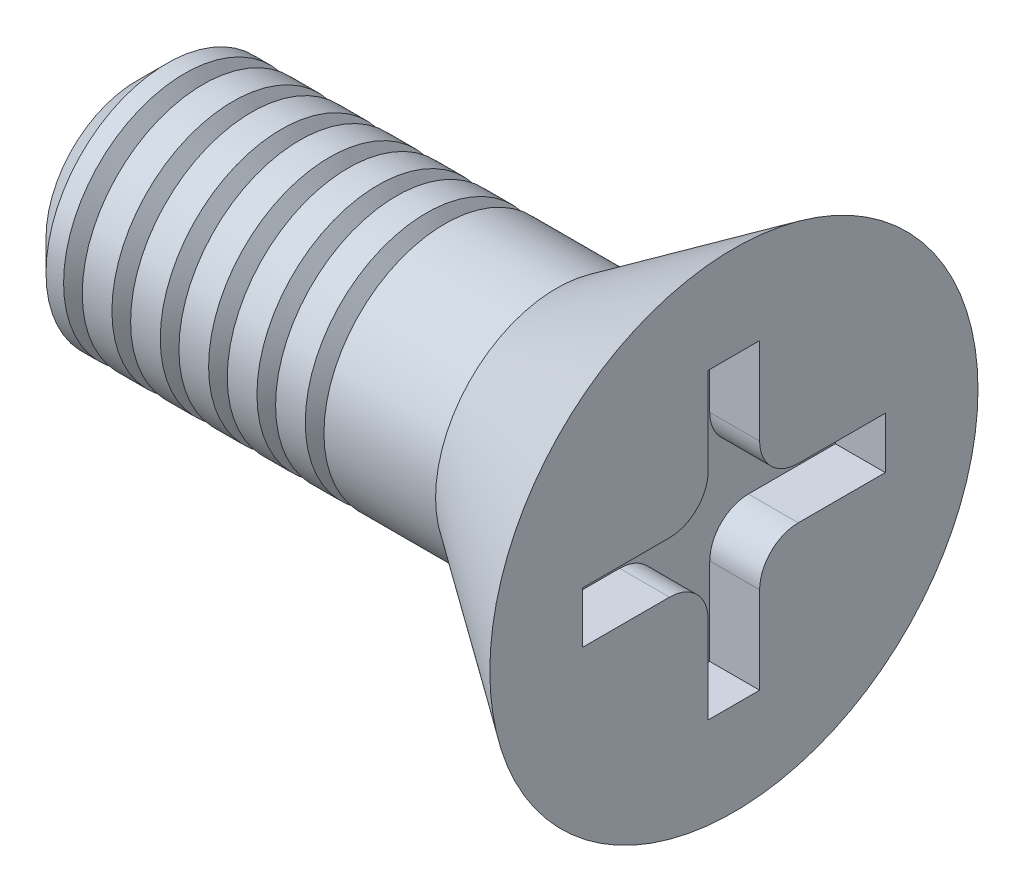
SolidWorks part; units mm, degrees
ref_plane "Front Plane" through (0, 0, 0) normal (0, 0, 1) x (1, 0, 0)
ref_plane "Top Plane" through (0, 0, 0) normal (0, 1, 0) x (1, 0, 0)
ref_plane "Right Plane" through (0, 0, 0) normal (1, 0, 0) x (0, 0, -1)
sketch "Sketch1" plane through (0, 0, 0) normal (0, 0, 1) x (1, 0, 0)
  line L0 (3.175, 0) -> (0, 0) construction
  line L1 (3.175, 0) -> (3.175, 3.2068)
  line L2 (3.175, 3.2068) -> (0.8458, 1.59)
  line L3 (0.8458, 1.59) -> (0, 1.59)
  line L4 (0, 1.59) -> (0, 0)
  line L5 (0, 0) -> (3.175, 0)
  dimension "D1" = 6.4135
  dimension "D2" = 3.1801
revolve "Revolve1" add sketch "Sketch1" angle 360 about L0
sketch "Sketch2" plane through (0, 0, 0) normal (-1, 0, 0) x (0, 0, 1)
  circle A1 centre (0, 0) radius 1.59
  circle A2 centre (0, 0) radius 1.59
  dimension "D1" = 0
extrude "Boss-Extrude1" add sketch "Sketch2" along normal blind 4.6711
chamfer "Chamfer1" distance 0.3988 angle 45 1 edges at (-4.6711, 0, 1.59)
sketch "Sketch3" plane through (3.175, 0, 0) normal (1, 0, 0) x (0, 0, -1)
  line L0 (0, 3.2068) -> (0, 0) construction
  line L1 (0, 0) -> (-3.2068, 0) construction
  line L2 (-0.3378, 1.9888) -> (-0.3378, 0.3378)
  line L3 (-0.3378, 0.3378) -> (-1.9888, 0.3378)
  line L4 (0.3378, 1.9888) -> (0.3378, 0.3378)
  line L5 (0.3378, 0.3378) -> (1.9888, 0.3378)
  line L6 (-0.3378, -0.3378) -> (-1.9888, -0.3378)
  line L7 (-0.3378, -1.9888) -> (-0.3378, -0.3378)
  line L8 (0.3378, -1.9888) -> (0.3378, -0.3378)
  line L9 (0.3378, -0.3378) -> (1.9888, -0.3378)
  line L10 (-1.9888, 0.3378) -> (-1.9888, -0.3378)
  line L11 (-0.3378, -1.9888) -> (0.3378, -1.9888)
  line L12 (1.9888, -0.3378) -> (1.9888, 0.3378)
  line L13 (0.3378, 1.9888) -> (-0.3378, 1.9888)
  circle A0 centre (0, 0) radius 3.2068 construction
  point P9 (-1.1633, 0.3378)
  dimension "D1" = 0.6756
  dimension "D2" = 0.6756
  dimension "D3" = 1.651
  dimension "D4" = 1.651
extrude "Cut-Extrude1" cut sketch "Sketch3" against normal blind 0.6553
fillet "Fillet1" radius 0.508 4 edges at (2.8473, -0.3378, 0.3378) (2.8473, -0.3378, -0.3378) (2.8473, 0.3378, -0.3378) (2.8473, 0.3378, 0.3378)
sketch "Sketch4" plane through (0, 0, 0) normal (0, 0, 1) x (1, 0, 0)
  line L0 (-4.1998, 1.8428) -> (-3.9175, 1.3927)
  line L1 (-3.9175, 1.3927) -> (-3.6403, 1.8428)
  line L2 (-3.6403, 1.8428) -> (-4.1998, 1.8428)
  line L3 (-4.2723, 0) -> (0.8458, 0) construction
  line L4 (-4.2723, -1.59) -> (-4.2723, 1.59) construction
  line L5 (0.8458, 1.59) -> (0.8458, -1.59) construction
  line L6 (-3.6373, 0) -> (1.4808, 0) construction
  line L7 (-3.5648, 1.8428) -> (-3.2825, 1.3927)
  line L8 (-3.2825, 1.3927) -> (-3.0053, 1.8428)
  line L9 (-3.0053, 1.8428) -> (-3.5648, 1.8428)
  line L10 (-3.0023, 0) -> (2.1158, 0) construction
  line L11 (-2.9298, 1.8428) -> (-2.6475, 1.3927)
  line L12 (-2.6475, 1.3927) -> (-2.3703, 1.8428)
  line L13 (-2.3703, 1.8428) -> (-2.9298, 1.8428)
  line L14 (-2.3673, 0) -> (2.7508, 0) construction
  line L15 (-2.2948, 1.8428) -> (-2.0125, 1.3927)
  line L16 (-2.0125, 1.3927) -> (-1.7353, 1.8428)
  line L17 (-1.7353, 1.8428) -> (-2.2948, 1.8428)
  line L18 (-1.7323, 0) -> (3.3858, 0) construction
  line L19 (-1.6598, 1.8428) -> (-1.3775, 1.3927)
  line L20 (-1.3775, 1.3927) -> (-1.1003, 1.8428)
  line L21 (-1.1003, 1.8428) -> (-1.6598, 1.8428)
  line L22 (-1.0973, 0) -> (4.0208, 0) construction
  line L23 (-1.0248, 1.8428) -> (-0.7425, 1.3927)
  line L24 (-0.7425, 1.3927) -> (-0.4653, 1.8428)
  line L25 (-0.4653, 1.8428) -> (-1.0248, 1.8428)
  dimension "D1" = 6
revolve "Cut-Revolve1" cut sketch "Sketch4" angle 360 about L3
